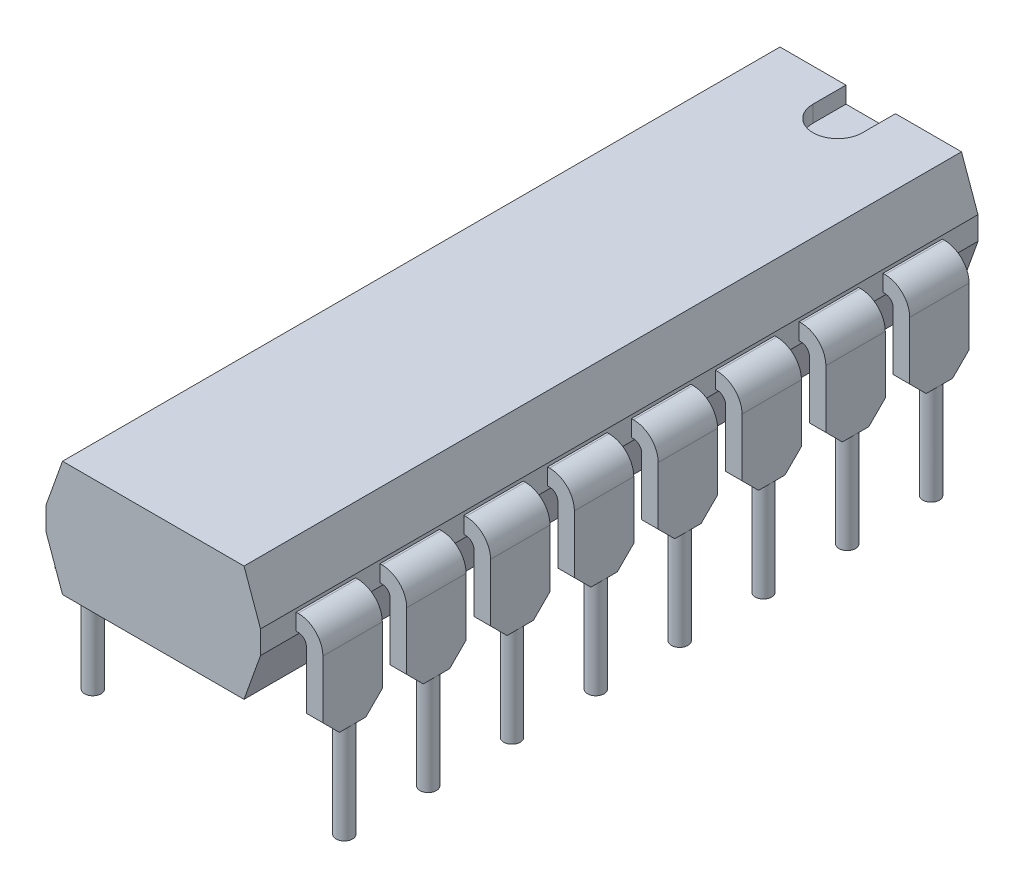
SolidWorks part; units mm, degrees
ref_plane "Plan1" through (0, 0, 0) normal (0, 0, 1) x (1, 0, 0)
ref_plane "Plan2" through (0, 0, 0) normal (0, 1, 0) x (1, 0, 0)
ref_plane "Plan3" through (0, 0, 0) normal (1, 0, 0) x (0, 0, -1)
sketch "Esquisse1" plane through (0, 0, 0) normal (0, 0, 1) x (1, 0, 0)
  line L0 (-50, 0) -> (100, 0) construction
  line L1 (-3.25, -0.35) -> (-3.25, 0.35)
  line L2 (-3.25, 0.35) -> (-2.75, 1.75)
  line L3 (-2.75, 1.75) -> (2.75, 1.75)
  line L4 (0, -34.1059) -> (0, 76.0343) construction
  line L5 (3.25, 0.35) -> (2.75, 1.75)
  line L6 (3.25, -0.35) -> (3.25, 0.35)
  line L7 (3.25, -0.35) -> (2.75, -1.75)
  line L8 (-2.75, -1.75) -> (2.75, -1.75)
  line L9 (-3.25, -0.35) -> (-2.75, -1.75)
  point P3 (0, -1.75)
  point P10 (0, 1.75)
  point P13 (3.25, 0)
  point P16 (-3.25, 0)
  dimension "D1" = 0.35
  dimension "D2" = 1.75
  dimension "D3" = 3.25
  dimension "D4" = 2.75
extrude "Base-Extrusion" add sketch "Esquisse1" along normal blind 21.74
sketch "Esquisse6" plane through (0, 1.75, 0) normal (0, 1, 0) x (-1, 0, 0)
  line L0 (-0.75, 1) -> (-0.75, 0)
  line L1 (-2.75, 0) -> (2.75, 0) construction
  line L2 (0.75, 1) -> (0.75, 0)
  line L3 (0.75, 0) -> (-0.75, 0)
  arc A0 (0.75, 1) -> (-0.75, 1) centre (0, 1) ccw
  dimension "D1" = 1.5
  dimension "D2" = 1
extrude "Enlèv. mat.-Extru.3" cut sketch "Esquisse6" against normal blind 0.5
ref_plane "Plan4" through (0, 0, 19.76) normal (0, 0, 1) x (1, 0, 0)
sketch "Esquisse3" plane through (0, 0, 19.76) normal (0, 0, 1) x (1, 0, 0)
  line L0 (-40.4532, 0) -> (-32.928, 0) construction
  line L1 (3.25, 0.25) -> (3.31, 0.25)
  line L2 (3.25, -0.35) -> (3.25, 0.35) construction
  line L3 (4.06, -0.5) -> (4.06, -2.75)
  line L4 (3.25, -0.25) -> (3.31, -0.25)
  line L5 (3.56, -0.5) -> (3.56, -2.75)
  line L6 (0, 7.4385) -> (0, -5.8183) construction
  line L7 (4.06, -2.75) -> (3.56, -2.75)
  line L8 (3.25, -0.25) -> (3.25, 0.25)
  arc A0 (3.56, -0.5) -> (3.31, -0.25) centre (3.31, -0.5) ccw
  arc A1 (4.06, -0.5) -> (3.31, 0.25) centre (3.31, -0.5) ccw
  point P18 (4.06, 0.25)
  dimension "D6" = 0.25
  dimension "D7" = 0.75
  dimension "D1" = 0.25
  dimension "D2" = 3.25
  dimension "D3" = 0.5
  dimension "D4" = 3.56
  dimension "D5" = 3
extrude "Boss.-Extru.1" add sketch "Esquisse3" along normal mid plane 1.8
chamfer "Chanfrein1" distance 0.5 angle 45
pattern_linear "Répétition linéaire1"
mirror "Symétrie1"
extrude "Boss.-Extru.2" add sketch "Esquisse4" along normal blind 3
sketch "Esquisse4" plane through (0, -2.75, 0) normal (0, -1, 0) x (1, 0, 0)
  line L1 (3.81, 8.0669) -> (3.81, 10.6279) construction
  line L2 (4.06, 20.16) -> (4.06, 19.36) construction
  line L3 (-33.4793, 19.76) -> (-31.8215, 19.76) construction
  line L4 (3.25, 19.76) -> (-3.25, 19.76) construction
  circle A0 centre (3.81, 19.76) radius 0.25
  dimension "D1" = 0.25
  dimension "D2" = 0.5
